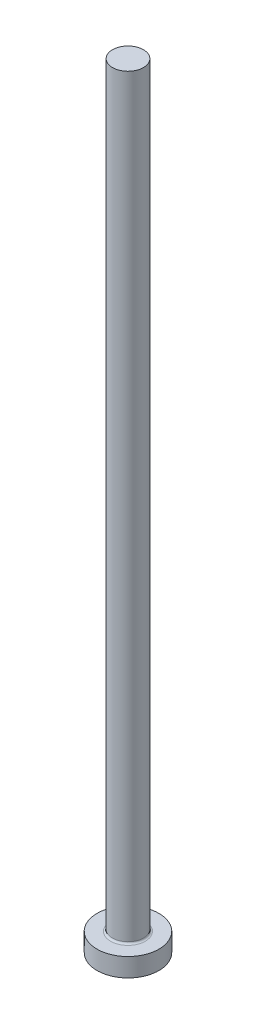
SolidWorks part; units mm, degrees
ref_plane "Plano frontal" through (0, 0, 0) normal (0, 0, 1) x (1, 0, 0)
ref_plane "Plano superior" through (0, 0, 0) normal (0, 1, 0) x (1, 0, 0)
ref_plane "Plano direito" through (0, 0, 0) normal (1, 0, 0) x (0, 0, -1)
sketch "Esboço1" plane through (0, 0, 0) normal (0, 0, 1) x (1, 0, 0)
  line L0 (0, 0) -> (5, 0)
  line L1 (5, 0) -> (5, 3)
  line L2 (5, 3) -> (2.8, 3)
  line L3 (2.5, 3.3) -> (2.5, 125)
  line L4 (2.5, 125) -> (0, 125)
  line L5 (0, 125) -> (0, 0) construction
  line L6 (0, 0) -> (0, 125)
  arc A0 (2.8, 3) -> (2.5, 3.3) centre (2.8, 3.3) cw
  dimension "D3" = 0.3
  dimension "D1" = 10
  dimension "D2" = 5
  dimension "D4" = 3
  dimension "D5" = 125
revolve "Revolução1" add sketch "Esboço1" angle 360 about L5
sketch "Esboço2"
  dimension "D1" = 0.375
  dimension "D2" = 0.875
  dimension "D3" = 0.5625
  dimension "D4" = 2.6875
wrap "Envolver1" sketch "Esboço2" wrap type deboss source sketch "Esboço2" thickness 0.1 parameters "D1"=0.1
